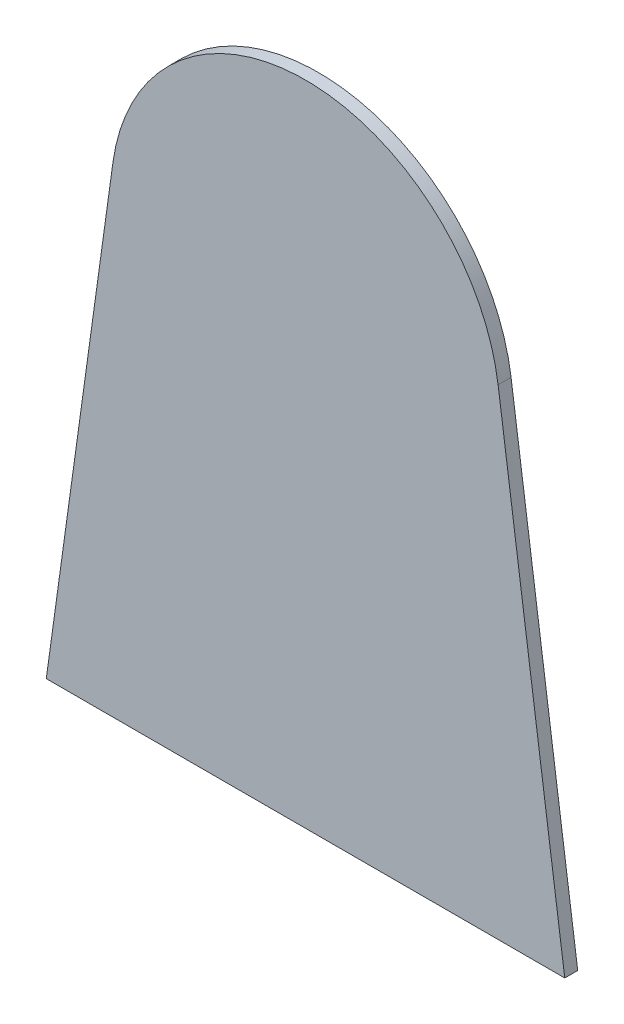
SolidWorks part; units mm, degrees
ref_plane "Front Plane" through (0, 0, 0) normal (0, 0, 1) x (1, 0, 0)
ref_plane "Top Plane" through (0, 0, 0) normal (0, 1, 0) x (1, 0, 0)
ref_plane "Right Plane" through (0, 0, 0) normal (1, 0, 0) x (0, 0, -1)
sketch "Sketch1" plane through (0, 0, 0) normal (0, 0, 1) x (1, 0, 0)
  line L0 (0, 0) -> (0, 500) construction
  line L1 (0, 0) -> (200, 0)
  line L2 (0, 0) -> (-200, 0)
  line L3 (0, 500) -> (0, 350) construction
  line L4 (-200, 0) -> (-148.5766, 370.6152)
  line L5 (200, 0) -> (148.5766, 370.6152)
  arc A0 (148.5766, 370.6152) -> (-148.5766, 370.6152) centre (0, 350) ccw
  dimension "D1" = 500
  dimension "D2" = 200
  dimension "D3" = 200
  dimension "D4" = 150
extrude "Boss-Extrude1" add sketch "Sketch1" along normal blind 10
